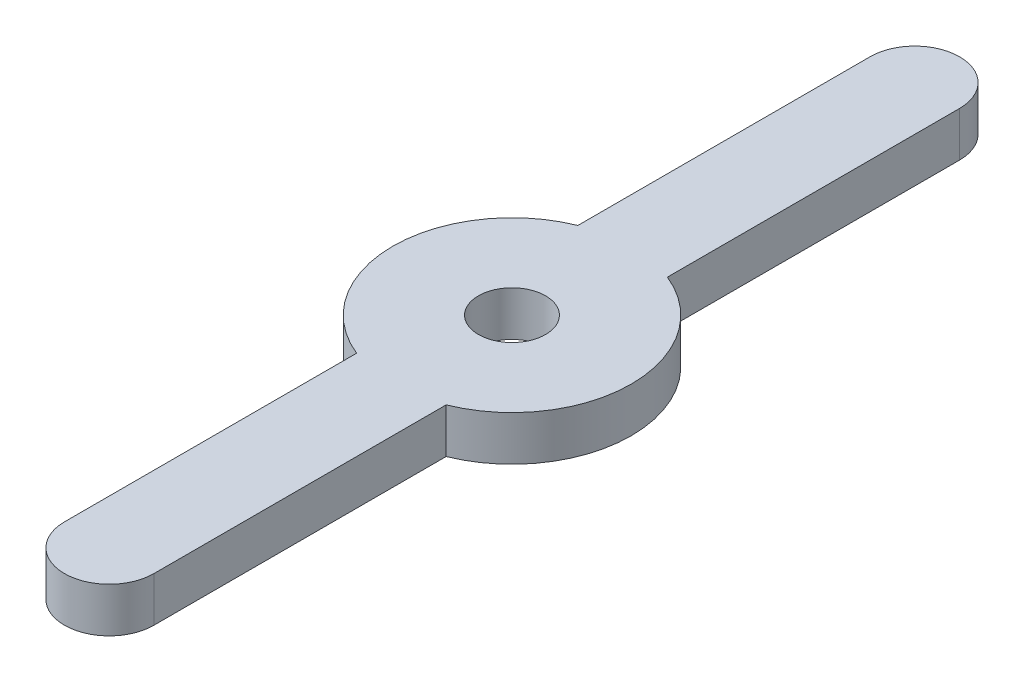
SolidWorks part; units mm, degrees
ref_plane "Front Plane" through (0, 0, 0) normal (0, 0, 1) x (1, 0, 0)
ref_plane "Top Plane" through (0, 0, 0) normal (0, 1, 0) x (1, 0, 0)
ref_plane "Right Plane" through (0, 0, 0) normal (1, 0, 0) x (0, 0, -1)
sketch "Sketch1" plane through (0, 0, 0) normal (0, 1, 0) x (1, 0, 0)
  line L0 (0, 0) -> (0, 54) construction
  line L1 (-3, 54) -> (-3, 34.4162)
  line L2 (3, 54) -> (3, 34.4162)
  line L3 (3, 19.5838) -> (3, 0)
  line L4 (-3, 19.5838) -> (-3, 0)
  arc A0 (-3, 0) -> (3, 0) centre (0, 0) ccw
  arc A1 (3, 54) -> (-3, 54) centre (0, 54) ccw
  circle A2 centre (0, 27) radius 2.25
  arc A3 (-3, 34.4162) -> (-3, 19.5838) centre (0, 27) ccw
  arc A4 (3, 19.5838) -> (3, 34.4162) centre (0, 27) ccw
  dimension "D1" = 6
  dimension "D2" = 16
  dimension "D3" = 4.5
  dimension "D4" = 54
extrude "Extrude1" add sketch "Sketch1" along normal blind 3
